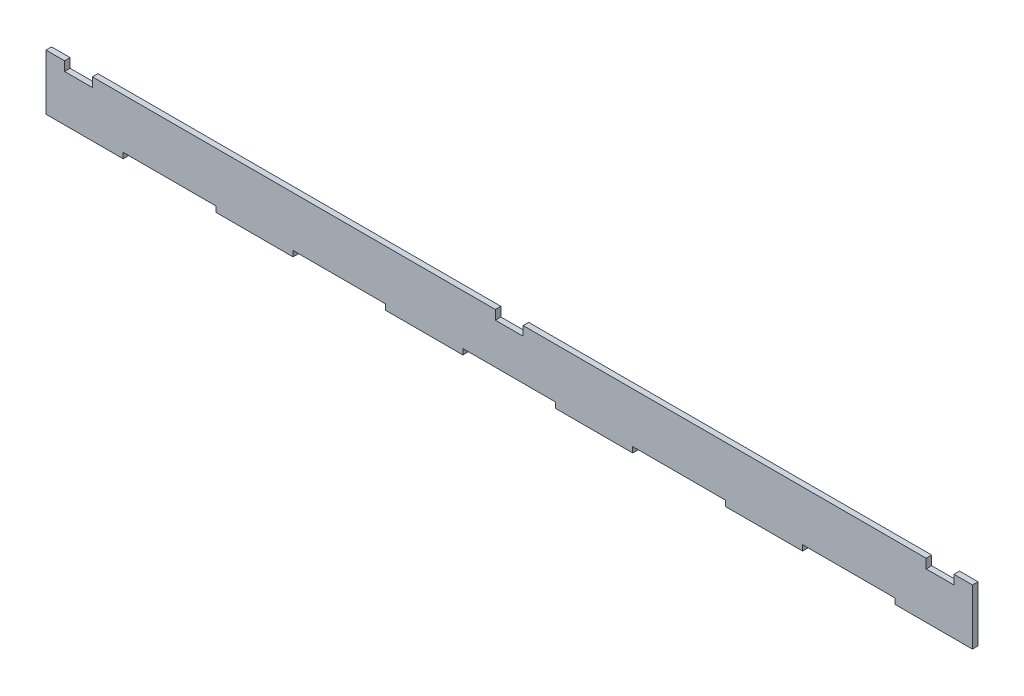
SolidWorks part; units mm, degrees
ref_plane "Ebene vorne" through (0, 0, 0) normal (0, 0, 1) x (1, 0, 0)
ref_plane "Ebene oben" through (0, 0, 0) normal (0, 1, 0) x (1, 0, 0)
ref_plane "Ebene rechts" through (0, 0, 0) normal (1, 0, 0) x (0, 0, -1)
sketch "Skizze1" plane through (0, 0, 0) normal (0, 0, 1) x (1, 0, 0)
  line L1 (0, 0) -> (500, 0)
  line L2 (0, 0) -> (0, 30)
  line L3 (0, 30) -> (500, 30)
  line L4 (500, 0) -> (500, 30)
  dimension "L" = 500
  dimension "D2" = 30
extrude "Aufsatz-Linear austragen1" add sketch "Skizze1" along normal blind 3
sketch "Skizze2" plane through (0, 0, 0) normal (0, 0, 1) x (1, 0, 0)
  line L0 (500, 30) -> (0, 30) construction
  line L1 (10, 30) -> (25, 30)
  line L2 (10, 30) -> (10, 25)
  line L3 (10, 25) -> (25, 25)
  line L4 (25, 30) -> (25, 25)
  dimension "L1" = 10
  dimension "L2" = 15
  dimension "D3" = 5
extrude "Schnitt-Linear austragen1" cut sketch "Skizze2" along normal up to surface (3 mm away)
pattern_linear "Lineares Muster1" count 3 spacing 232.5 along (1, 0, 0) of "Schnitt-Linear austragen1"
sketch "Skizze3" plane through (0, 0, 0) normal (0, 0, 1) x (1, 0, 0)
  line L0 (0, 0) -> (500, 0) construction
  line L1 (41.6667, 0) -> (91.6667, 0)
  line L2 (41.6667, 0) -> (41.6667, 3)
  line L3 (41.6667, 3) -> (91.6667, 3)
  line L4 (91.6667, 0) -> (91.6667, 3)
  dimension "D1" = 50
  dimension "D2" = 3
  dimension "D3" = 41.6667
extrude "Schnitt-Linear austragen2" cut sketch "Skizze3" along normal up to surface (3 mm away)
pattern_linear "Lineares Muster2" count 5 spacing 91.6667 along (1, 0, 0) of "Schnitt-Linear austragen2"
equation "\"D3@Lineares Muster1\" = (\"L@Skizze1\"-2*\"L1@Skizze2\"-\"L2@Skizze2\")/(\"D1@Lineares Muster1\"-1)"
equation "\"D3@Lineares Muster2\" =(\"L@Skizze1\"-\"D1@Lineares Muster2\"*\"D1@Skizze3\")/(\"D1@Lineares Muster2\"+1)+\"D1@Skizze3\""
equation "\"D3@Skizze3\" = (\"L@Skizze1\"-\"D1@Lineares Muster2\"*\"D1@Skizze3\")/(\"D1@Lineares Muster2\"+1)"
